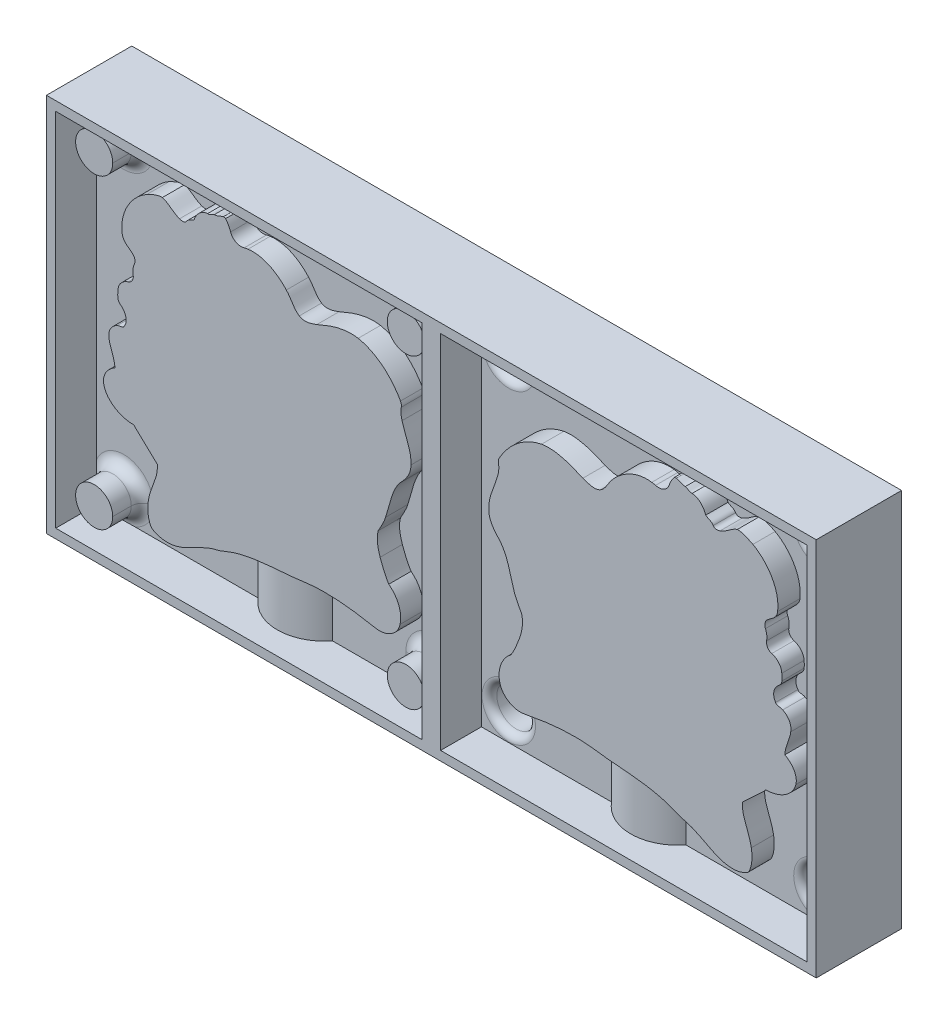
SolidWorks part; units mm, degrees
other "Boss.-Extru.6[1]" parameters "D1"=11.3759, "D2"=14.6516, "D3"=12.7526, "D4"=11.0933
ref_plane "Plan de face" through (0, 0, 0) normal (1, 0, 0) x (0, 1, 0)
ref_plane "Plan de dessus" through (0, 0, 0) normal (0, 0, 1) x (0, 1, 0)
ref_plane "Plan de droite" through (0, 0, 0) normal (0, 1, 0) x (-1, 0, 0)
imported_body "carteMold.STEP<1>"
ref_plane "Plan1" through (0, 0, -2) normal (0, 0, -1) x (0, 1, 0)
sketch "Esquisse3" plane through (0, 0, 16) normal (0, 0, 1) x (1, 0, 0)
  line L1 (25.1947, 51.706) -> (162.3651, 51.706)
  line L2 (25.1947, 51.706) -> (25.1947, 171.5636)
  line L3 (25.1947, 171.5636) -> (162.3651, 171.5636)
  line L4 (162.3651, 51.706) -> (162.3651, 171.5636)
  line L5 (25.1947, 51.706) -> (162.3651, 171.5636) construction
  line L6 (25.1947, 171.5636) -> (162.3651, 51.706) construction
  point P0 (93.7799, 111.6348)
extrude "Enlèv. mat.-Extru.2" cut sketch "Esquisse3" against normal blind 5 and the other way through all
ref_plane "Plan2" through (147.0067, 0, 0) normal (1, 0, 0) x (0, 1, 0)
mirror "Symétrie4" about plane through (147.0067, 0, 0) normal (1, 0, 0)
sketch "Esquisse5" plane through (0, 56.4706, 0) normal (0, -1, 0) x (1, 0, 0)
  line L1 (43.2639, -2) -> (250.7494, -2)
  line L2 (43.2639, -2) -> (43.2639, -12)
  line L3 (43.2639, -12) -> (250.7494, -12)
  line L4 (250.7494, -2) -> (250.7494, -12)
  point P5 (250.7494, -2)
  dimension "D1" = 10
extrude "Boss.-Extru.1" add sketch "Esquisse5" against normal up to surface (102.3047 mm away)
sketch "Esquisse6" plane through (0, 0, 8) normal (0, 0, 1) x (1, 0, 0)
  circle A0 centre (156.878, 148.885) radius 5.2
  circle A1 centre (240.878, 148.885) radius 5.2
  circle A2 centre (240.878, 66.361) radius 5.2
  circle A3 centre (156.878, 66.361) radius 5.2
extrude "Enlèv. mat.-Extru.4" cut sketch "Esquisse6" against normal blind 16.4
sketch "Esquisse7" plane through (0, 0, 0) normal (0, 0, 1) x (1, 0, 0)
  line L0 (149.5067, 58.9706) -> (149.5067, 156.2753) construction
  line L1 (149.5067, 156.2753) -> (166.7786, 156.2753)
  line L2 (149.5067, 156.2753) -> (149.5067, 139.8014)
  line L3 (149.5067, 139.8014) -> (166.7786, 139.8014)
  line L4 (166.7786, 156.2753) -> (166.7786, 139.8014)
  line L5 (248.2494, 156.2753) -> (232.3317, 156.2753)
  line L6 (248.2494, 156.2753) -> (248.2494, 142.805)
  line L9 (248.2494, 58.9706) -> (230.8194, 58.9706)
  line L10 (248.2494, 58.9706) -> (248.2494, 76.0948)
  line L11 (248.2494, 76.0948) -> (230.8194, 76.0948)
  line L12 (230.8194, 58.9706) -> (230.8194, 76.0948)
  line L13 (149.5067, 58.9706) -> (162.2867, 58.9706)
  line L14 (149.5067, 58.9706) -> (149.5067, 73.8998)
  line L17 (248.2494, 58.9706) -> (149.5067, 58.9706) construction
  arc A0 (149.5067, 73.8998) -> (162.2867, 58.9706) centre (156.1979, 66.6931) cw
  arc A1 (232.3317, 156.2753) -> (248.2494, 142.805) centre (240.6583, 149.9747) ccw
extrude "Enlèv. mat.-Extru.5" cut sketch "Esquisse7" along normal blind 16.4
fillet "Congé1" radius 2 4 edges at (151.678, 66.361, 0) (246.078, 66.361, 0) (246.078, 148.885, 0) (162.078, 148.885, 0)
equation "\"D2@Esquisse6\"=\"D1@Esquisse6\""
equation "\"D3@Esquisse6\"=\"D2@Esquisse6\""
equation "\"D4@Esquisse6\"=\"D1@Esquisse6\""
